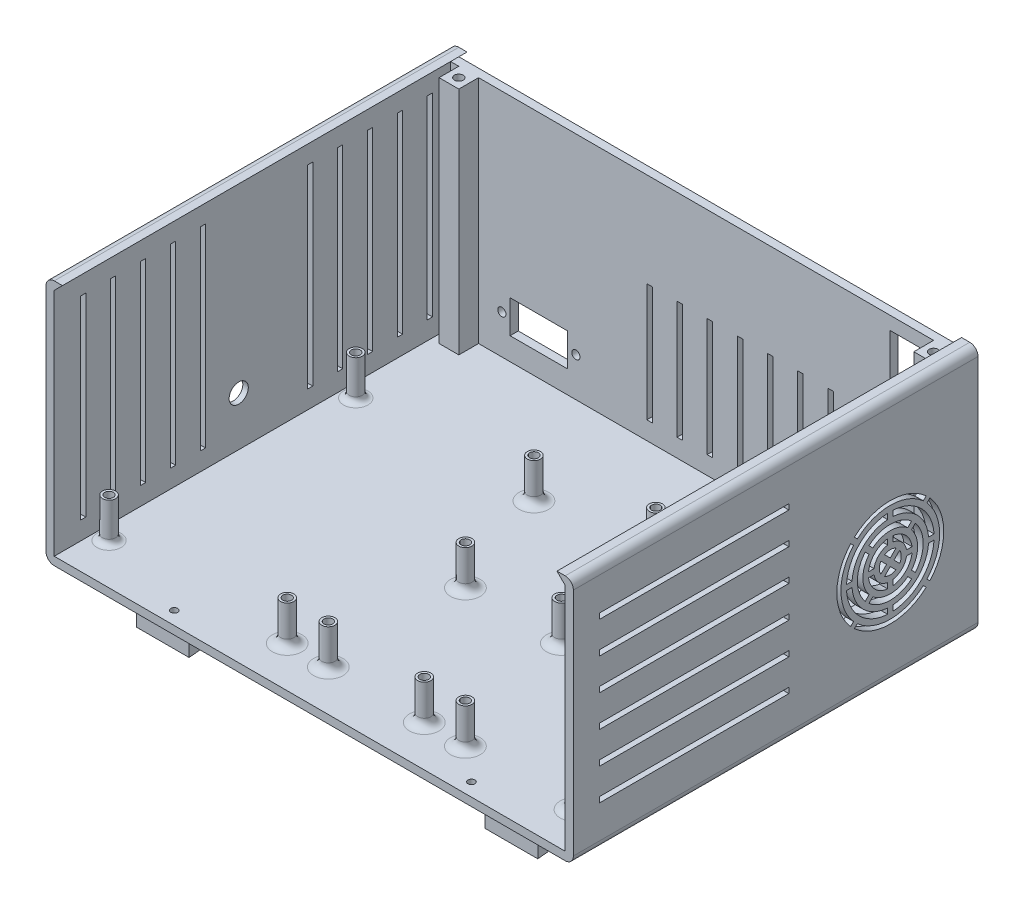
SolidWorks part; units mm, degrees
ref_plane "Front Plane" through (0, 0, 0) normal (0, 0, 1) x (1, 0, 0)
ref_plane "Top Plane" through (0, 0, 0) normal (0, 1, 0) x (1, 0, 0)
ref_plane "Right Plane" through (0, 0, 0) normal (1, 0, 0) x (0, 0, -1)
sketch "Sketch3" plane through (0, 0, 0) normal (0, 1, 0) x (1, 0, 0)
  line L1 (0, 0) -> (192.4, 0)
  line L2 (0, 0) -> (0, 147.6)
  line L3 (0, 147.6) -> (192.4, 147.6)
  line L4 (192.4, 0) -> (192.4, 147.6)
  dimension "D1" = 147.6
  dimension "D2" = 192.4
extrude "Boss-Extrude1" add sketch "Sketch3" against normal blind 3
sketch "Sketch4" plane through (0, 0, 0) normal (0, 1, 0) x (1, 0, 0)
  line L0 (192.4, 147.6) -> (0, 147.6) construction
  line L1 (0, 0) -> (3, 0)
  line L2 (0, 0) -> (0, 147.6)
  line L3 (0, 147.6) -> (3, 147.6)
  line L4 (3, 0) -> (3, 147.6)
  line L10 (192.4, 0) -> (189.4, 0)
  line L11 (192.4, 0) -> (192.4, 147.6)
  line L12 (192.4, 147.6) -> (189.4, 147.6)
  line L13 (189.4, 0) -> (189.4, 147.6)
  line L14 (3, 147.6) -> (189.4, 147.6)
  line L15 (3, 147.6) -> (3, 144.6)
  line L16 (3, 144.6) -> (189.4, 144.6)
  line L17 (189.4, 147.6) -> (189.4, 144.6)
  dimension "D1" = 3
  dimension "D2" = 3
  dimension "D3" = 3
extrude "Boss-Extrude3" add sketch "Sketch4" along normal blind 87 contours L4 L16 L13 M10
sketch "Sketch5" plane through (0, 0, 0) normal (-1, 0, 0) x (0, 0, 1)
  line L0 (0, 87) -> (-147.6, 87) construction
  line L1 (-138, 77.4) -> (-136.08, 77.4)
  line L2 (-138, 77.4) -> (-138, 6.6)
  line L3 (-138, 6.6) -> (-136.08, 6.6)
  line L4 (-136.08, 77.4) -> (-136.08, 6.6)
  line L5 (-147.6, -3) -> (0, -3) construction
  line L6 (-147.6, -3) -> (-147.6, 87) construction
  line L7 (-127.08, 77.4) -> (-127.08, 6.6)
  line L8 (-127.08, 77.4) -> (-125.16, 77.4)
  line L9 (-125.16, 77.4) -> (-125.16, 6.6)
  line L10 (-127.08, 6.6) -> (-125.16, 6.6)
  line L11 (-116.16, 77.4) -> (-116.16, 6.6)
  line L12 (-116.16, 77.4) -> (-114.24, 77.4)
  line L13 (-114.24, 77.4) -> (-114.24, 6.6)
  line L14 (-116.16, 6.6) -> (-114.24, 6.6)
  line L15 (-105.24, 77.4) -> (-105.24, 6.6)
  line L16 (-105.24, 77.4) -> (-103.32, 77.4)
  line L17 (-103.32, 77.4) -> (-103.32, 6.6)
  line L18 (-105.24, 6.6) -> (-103.32, 6.6)
  line L19 (-94.32, 77.4) -> (-94.32, 6.6)
  line L20 (-94.32, 77.4) -> (-92.4, 77.4)
  line L21 (-92.4, 77.4) -> (-92.4, 6.6)
  line L22 (-94.32, 6.6) -> (-92.4, 6.6)
  line L23 (-73.8, 87) -> (-73.8, -3) construction
  line L24 (0, -3) -> (0, 87) construction
  line L25 (-53.28, 77.4) -> (-55.2, 77.4)
  line L26 (-55.2, 77.4) -> (-55.2, 6.6)
  line L27 (-53.28, 77.4) -> (-53.28, 6.6)
  line L28 (-53.28, 6.6) -> (-55.2, 6.6)
  line L29 (-42.36, 6.6) -> (-44.28, 6.6)
  line L30 (-42.36, 77.4) -> (-44.28, 77.4)
  line L31 (-44.28, 77.4) -> (-44.28, 6.6)
  line L32 (-42.36, 77.4) -> (-42.36, 6.6)
  line L33 (-31.44, 6.6) -> (-33.36, 6.6)
  line L34 (-33.36, 77.4) -> (-33.36, 6.6)
  line L35 (-31.44, 77.4) -> (-33.36, 77.4)
  line L36 (-31.44, 77.4) -> (-31.44, 6.6)
  line L37 (-20.52, 77.4) -> (-22.44, 77.4)
  line L38 (-22.44, 77.4) -> (-22.44, 6.6)
  line L39 (-20.52, 77.4) -> (-20.52, 6.6)
  line L40 (-20.52, 6.6) -> (-22.44, 6.6)
  line L41 (-9.6, 6.6) -> (-11.52, 6.6)
  line L42 (-9.6, 77.4) -> (-11.52, 77.4)
  line L43 (-9.6, 77.4) -> (-9.6, 6.6)
  line L44 (-11.52, 77.4) -> (-11.52, 6.6)
  dimension "D1" = 1.92
  dimension "D2" = 9.6
  dimension "D3" = 9.6
  dimension "D4" = 9.6
  dimension "D6" = 9
  dimension "D7" = 73.8
  dimension "D5" = 5
extrude "Cut-Extrude2" cut sketch "Sketch5" against normal up to surface (3 mm away)
sketch "Sketch6" plane through (192.4, 0, 0) normal (1, 0, 0) x (0, 0, -1)
  line L0 (0, 87) -> (147.6, 87) construction
  line L1 (9.6, 72) -> (78.6, 72)
  line L2 (9.6, 72) -> (9.6, 70)
  line L3 (9.6, 70) -> (78.6, 70)
  line L4 (78.6, 72) -> (78.6, 70)
  line L5 (0, -3) -> (0, 87) construction
  line L6 (9.6, 58.4) -> (78.6, 58.4)
  line L7 (9.6, 60.4) -> (78.6, 60.4)
  line L8 (9.6, 60.4) -> (9.6, 58.4)
  line L9 (78.6, 60.4) -> (78.6, 58.4)
  line L10 (9.6, 46.8) -> (78.6, 46.8)
  line L11 (9.6, 48.8) -> (78.6, 48.8)
  line L12 (9.6, 48.8) -> (9.6, 46.8)
  line L13 (78.6, 48.8) -> (78.6, 46.8)
  line L14 (9.6, 35.2) -> (78.6, 35.2)
  line L15 (9.6, 37.2) -> (78.6, 37.2)
  line L16 (9.6, 37.2) -> (9.6, 35.2)
  line L17 (78.6, 37.2) -> (78.6, 35.2)
  line L18 (9.6, 23.6) -> (78.6, 23.6)
  line L19 (9.6, 25.6) -> (78.6, 25.6)
  line L20 (9.6, 25.6) -> (9.6, 23.6)
  line L21 (78.6, 25.6) -> (78.6, 23.6)
  line L22 (9.6, 12) -> (78.6, 12)
  line L23 (9.6, 14) -> (78.6, 14)
  line L24 (9.6, 14) -> (9.6, 12)
  line L25 (78.6, 14) -> (78.6, 12)
  line L30 (9.6, 2.4) -> (78.6, 2.4)
  line L31 (9.6, 0.4) -> (78.6, 0.4)
  line L32 (9.6, 2.4) -> (9.6, 0.4)
  line L33 (78.6, 2.4) -> (78.6, 0.4)
  dimension "D1" = 15
  dimension "D2" = 9.6
  dimension "D3" = 2
  dimension "D4" = 69
  dimension "D6" = 9.6
  dimension "D5" = 7
extrude "Cut-Extrude3" cut sketch "Sketch6" against normal up to surface (3 mm away)
sketch "Sketch7" plane through (192.4, 0, 0) normal (1, 0, 0) x (0, 0, -1)
  line L0 (0, -3) -> (147.6, -3) construction
  line L1 (147.6, -3) -> (147.6, 87) construction
  line L2 (96.1, 35) -> (135.1, 35) construction
  line L3 (115.6, 35) -> (101.8114, 48.7886)
  line L4 (115.6, 35) -> (129.3886, 48.7886)
  line L5 (115.6, 35) -> (129.3886, 21.2114)
  line L6 (101.8114, 21.2114) -> (115.6, 35)
  line L7 (109.2404, 42.7172) -> (102.507, 49.4507)
  line L8 (107.8828, 41.3596) -> (101.1493, 48.093)
  line L9 (109.2404, 27.2828) -> (102.507, 20.5493)
  line L10 (107.8828, 28.6404) -> (101.1493, 21.907)
  line L11 (115.6, 54.5) -> (115.6, 15.5) construction
  line L12 (121.9596, 27.2828) -> (128.693, 20.5493)
  line L13 (123.3172, 28.6404) -> (130.0507, 21.907)
  line L14 (123.3172, 41.3596) -> (130.0507, 48.093)
  line L15 (121.9596, 42.7172) -> (128.693, 49.4507)
  line L16 (116.56, 15.5236) -> (116.56, 54.4764)
  line L17 (114.64, 54.4764) -> (114.64, 15.5236)
  line L18 (96.1236, 35.96) -> (135.0764, 35.96)
  line L19 (96.1236, 34.04) -> (135.0764, 34.04)
  line L20 (107.8828, 41.3596) -> (121.9596, 27.2828)
  line L21 (109.2404, 42.7172) -> (123.3172, 28.6404)
  line L22 (107.8828, 28.6404) -> (121.9596, 42.7172)
  line L23 (123.3172, 41.3596) -> (109.2404, 27.2828)
  circle A0 centre (115.6, 35) radius 19.5
  circle A1 centre (115.6, 35) radius 18
  circle A2 centre (115.6, 35) radius 16
  circle A3 centre (115.6, 35) radius 14
  circle A4 centre (115.6, 35) radius 12
  circle A5 centre (115.6, 35) radius 10
  circle A6 centre (115.6, 35) radius 8
  circle A7 centre (115.6, 35) radius 6
  circle A8 centre (115.6, 35) radius 4
  circle A9 centre (115.6, 35) radius 2
  dimension "D3" = 39
  dimension "D4" = 36
  dimension "D5" = 32
  dimension "D6" = 28
  dimension "D8" = 24
  dimension "D9" = 20
  dimension "D18" = 16
  dimension "D19" = 12
  dimension "D20" = 8
  dimension "D21" = 4
  dimension "D1" = 38
  dimension "D2" = 32
  dimension "D7" = 45
  dimension "D10" = 90
  dimension "D11" = 45
  dimension "D12" = 0.96
  dimension "D13" = 0.96
  dimension "D14" = 0.96
  dimension "D15" = 0.96
  dimension "D16" = 0.96
  dimension "D17" = 0.96
extrude "Cut-Extrude5" cut sketch "Sketch7" against normal up to surface (3 mm away) contours A1 L19 A0 L10 | A1 L8 A0 L18 | A1 L17 A0 L7 | A1 L15 A0 L16 | A1 L16 A0 L17 | A1 L19 A0 L18 | A1 L18 A0 L14 | A1 L13 A0 L19 | A1 L16 A0 L12 | A1 L9 A0 L17 | A1 L17 A0 L16 | A1 L18 A0 L19 | A3 L19 A2 L10 | A3 L6 A2 L9 | A3 L10 A2 L6 | A3 L9 A2 L17 | A3 L16 A2 L12 | A3 L5 A2 L13 | A3 L12 A2 L5 | A3 L13 A2 L19 | A3 L18 A2 L14 | A3 L4 A2 L15 | A3 L14 A2 L4 | A3 L15 A2 L16 | A3 L17 A2 L7 | A3 L7 A2 L3 | A3 L3 A2 L8 | A3 L8 A2 L18 | A5 L18 A4 L19 | A5 L8 A4 L18 | A5 L17 A4 L7 | A5 L16 A4 L17 | A5 L15 A4 L16 | A5 L18 A4 L14 | A5 L13 A4 L19 | A5 L16 A4 L12 | A5 L9 A4 L17 | A5 L19 A4 L10 | A5 L17 A4 L16 | A5 L19 A4 L18 | A7 L19 A6 L22 | A7 L6 A6 L23 | A7 L22 A6 L6 | A7 L23 A6 L17 | A7 L16 A6 L20 | A7 L20 A6 L5 | A7 L5 A6 L21 | A7 L21 A6 L19 | A7 L18 A6 L23 | A7 L22 A6 L16 | A7 L23 A6 L4 | A7 L4 A6 L22 | A7 L20 A6 L18 | A7 L3 A6 L20 | A7 L21 A6 L3 | A9 L20 L18 A8 L19 L22 | A7 L17 A6 L21 | L19 A8 L22 | L20 A8 L18 | L20 A9 L22 | A9 L23 L17 A8 L16 L20 | A9 L21 L19 A8 L18 L23 | A9 L22 L16 A8 L17 L21 | L17 A8 L21 | L22 A8 L16 | L18 A8 L23 | L21 A8 L19 | L23 A9 L20 | L21 A9 L23 | L22 A9 L21
sketch "Sketch8" plane through (192.4, 0, 0) normal (1, 0, 0) x (0, 0, -1)
  line L0 (114.64, 32.6824) -> (113.5331, 31.5754)
  line L1 (116.56, 32.6824) -> (117.6669, 31.5754)
  line L2 (116.56, 31.1169) -> (116.56, 32.6824) construction
  line L3 (115.6, 33.6424) -> (114.64, 32.6824) construction
  line L4 (115.6, 33.6424) -> (116.56, 32.6824) construction
  line L5 (114.64, 32.6824) -> (114.64, 31.1169)
  line L6 (114.64, 32.6824) -> (114.64, 31.1169) construction
  line L7 (116.56, 32.6824) -> (116.56, 31.1169)
  circle A0 centre (115.6, 35) radius 4
  dimension "D1" = 8
extrude "Cut-Extrude6" cut sketch "Sketch8" against normal up to surface (3 mm away) contours L0 A0 L5 | L7 A0 L1
sketch "Sketch9" plane through (0, 0, 0) normal (0, 1, 0) x (1, 0, 0)
  line L0 (189.4, 0) -> (189.4, 144.6) construction
  line L1 (179.4, 133.8) -> (189.4, 133.8)
  line L2 (179.4, 133.8) -> (179.4, 93.8)
  line L3 (179.4, 93.8) -> (189.4, 93.8)
  line L4 (189.4, 133.8) -> (189.4, 93.8)
  line L5 (3, 144.6) -> (189.4, 144.6) construction
  dimension "D1" = 10.8
  dimension "D2" = 40
  dimension "D3" = 10
extrude "Boss-Extrude4" add sketch "Sketch9" along normal blind 15
sketch "Sketch13" plane through (189.4, 0, 0) normal (-1, 0, 0) x (0, 0, 1)
  line L0 (-115.6, 15.5) -> (-115.6, 54.5) construction
  line L1 (-135.1, 35) -> (-96.1, 35) construction
  line L2 (-93.8, 15) -> (-133.8, 15) construction
  line L3 (-133.8, 15) -> (-133.8, 0) construction
  arc A0 (-128.693, 20.5493) -> (-102.507, 20.5493) centre (-115.6, 35) ccw construction
  arc A1 (-102.507, 49.4507) -> (-128.693, 49.4507) centre (-115.6, 35) ccw construction
  arc A2 (-130.0507, 48.093) -> (-130.0507, 21.907) centre (-115.6, 35) ccw construction
  arc A3 (-101.1493, 21.907) -> (-101.1493, 48.093) centre (-115.6, 35) ccw construction
  circle A4 centre (-129.79, 19.01) radius 1.73
  circle A5 centre (-129.79, 50.99) radius 1.73
  circle A6 centre (-101.41, 50.99) radius 1.73
  circle A7 centre (-101.41, 19.01) radius 1.73
  dimension "D1" = 3.46
  dimension "D2" = 4.01
  dimension "D3" = 4.01
extrude "Boss-Extrude5" add sketch "Sketch13" along normal blind 12
fillet "Fillet1" radius 3 2 edges at (192.4, 87, -73.8) (0, 87, -73.8)
sketch "Sketch18" plane through (0, 0, 0) normal (0, 0, 1) x (1, 0, 0)
  line L0 (3, 87) -> (1.56, 84)
  line L1 (1.56, 84) -> (3, 84)
  line L2 (3, 87) -> (3, 0) construction
  line L3 (3, 84) -> (3, 87)
  line L4 (189.4, 87) -> (190.84, 84)
  line L5 (190.84, 84) -> (189.4, 84)
  line L6 (189.4, 87) -> (189.4, 0) construction
  line L7 (189.4, 87) -> (189.4, 84)
  dimension "D1" = 1.44
  dimension "D2" = 3
  dimension "D3" = 1.44
  dimension "D4" = 3
sketch "Sketch19" plane through (0, 0, -144.6) normal (0, 0, 1) x (1, 0, 0)
  line L0 (3, 87) -> (3, 84)
  line L1 (3, 87) -> (3, 0) construction
  line L2 (3, 84) -> (189.4, 84)
  line L3 (189.4, 87) -> (189.4, 0) construction
  line L4 (189.4, 84) -> (189.4, 87)
  line L5 (189.4, 87) -> (3, 87)
  dimension "D1" = 3
extrude "Cut-Extrude13" cut sketch "Sketch19" against normal up to surface (3 mm away) contours L2 M8 M6 M7
extrude "Cut-Extrude14" cut sketch "Sketch18" against normal through all
fillet "Fillet2" radius 3 2 edges at (192.4, -3, -73.8) (0, -3, -73.8)
sketch "Sketch20" plane through (0, 0, 0) normal (0, 0, 1) x (1, 0, 0)
  line L0 (1.56, 84) -> (3, 84)
  line L1 (3, 84) -> (6, 87)
  line L2 (6, 87) -> (3, 87)
  line L3 (3, 87) -> (1.56, 84)
  line L4 (189.4, 87) -> (190.84, 84)
  line L5 (190.84, 84) -> (189.4, 84)
  line L6 (189.4, 84) -> (186.4, 87)
  line L7 (186.4, 87) -> (189.4, 87)
  dimension "D1" = 3
  dimension "D2" = 1.44
  dimension "D3" = 3
extrude "Boss-Extrude6" add sketch "Sketch20" against normal up to surface (147.6 mm away)
sketch "Sketch21" plane through (0, 0, 0) normal (0, 1, 0) x (1, 0, 0)
  line L0 (3, 144.6) -> (189.4, 144.6) construction
  line L1 (6, 144.6) -> (13.2, 144.6)
  line L2 (6, 144.6) -> (6, 137.4)
  line L3 (6, 137.4) -> (13.2, 137.4)
  line L4 (13.2, 144.6) -> (13.2, 137.4)
  line L5 (3, 0) -> (3, 144.6) construction
  line L6 (189.4, 133.8) -> (189.4, 144.6) construction
  line L7 (186.4, 144.6) -> (179.2, 144.6)
  line L8 (186.4, 144.6) -> (186.4, 137.4)
  line L9 (186.4, 137.4) -> (179.2, 137.4)
  line L10 (179.2, 144.6) -> (179.2, 137.4)
  dimension "D1" = 3
  dimension "D2" = 7.2
  dimension "D3" = 7.2
  dimension "D4" = 3
  dimension "D5" = 7.2
  dimension "D6" = 7.2
extrude "Boss-Extrude7" add sketch "Sketch21" along normal blind 84
sketch "Sketch23" plane through (0, 0, 0) normal (0, 1, 0) x (1, 0, 0)
  line L0 (13.2, 144.6) -> (179.2, 144.6) construction
  line L1 (179.2, 144.6) -> (179.2, 137.4) construction
  circle A0 centre (167.4, 116.1) radius 2.4
  circle A1 centre (106.4, 116.1) radius 2.4
  dimension "D1" = 4.8
  dimension "D2" = 4.8
  dimension "D4" = 11.8
  dimension "D3" = 28.5
  dimension "D5" = 72.8
extrude "Transformer nails" add sketch "Sketch23" along normal blind 9
sketch "Sketch25" plane through (0, 0, 0) normal (0, 1, 0) x (1, 0, 0)
  line L1 (3, 0) -> (3, 144.6) construction
  line L2 (3, 0) -> (189.4, 0) construction
  line L3 (189.4, 0) -> (189.4, 93.8) construction
  circle A0 centre (42, 4.8) radius 1.25
  circle A1 centre (150.4, 4.8) radius 1.25
  dimension "D1" = 2.5
  dimension "D2" = 2.5
  dimension "D3" = 39
  dimension "D4" = 4.8
  dimension "D5" = 39
  dimension "D6" = 4.8
sketch "Sketch27" plane through (0, 0, 0) normal (0, 1, 0) x (1, 0, 0)
  line L0 (3, 0) -> (3, 144.6) construction
  line L1 (3, 10) -> (78, 10)
  line L2 (78, 10) -> (78, 110)
  line L3 (78, 110) -> (3, 110)
  line L4 (3, 110) -> (3, 10)
  line L5 (3, 0) -> (189.4, 0) construction
  line L6 (40.5, 110) -> (40.5, 10) construction
  line L8 (3, 60) -> (78, 60) construction
  circle A0 centre (8, 15) radius 2.4
  circle A1 centre (73, 15) radius 2.4
  circle A2 centre (73, 105) radius 2.4
  circle A3 centre (8, 105) radius 2.4
  dimension "D4" = 4.8
  dimension "D1" = 10
  dimension "D2" = 100
  dimension "D3" = 75
  dimension "D5" = 5
  dimension "D6" = 5
extrude "main PCB" add sketch "Sketch27" along normal blind 14.4 contours A0 | A3 | A2 | A1
sketch "Sketch28" plane through (0, 0, 0) normal (0, 1, 0) x (1, 0, 0)
  line L0 (83, 10) -> (128, 10) construction
  line L1 (128, 10) -> (128, 70) construction
  line L2 (128, 70) -> (83, 70) construction
  line L3 (83, 70) -> (83, 10) construction
  line L4 (189.4, 0) -> (189.4, 93.8) construction
  line L5 (3, 0) -> (189.4, 0) construction
  line L6 (3, 0) -> (3, 144.6) construction
  line L7 (105.5, 70) -> (105.5, 10) construction
  line L9 (83, 40) -> (128, 40) construction
  circle A0 centre (88, 15) radius 2.4
  circle A1 centre (88, 65) radius 2.4
  circle A2 centre (123, 15) radius 2.4
  circle A3 centre (123, 65) radius 2.4
  dimension "D5" = 4.8
  dimension "D1" = 45
  dimension "D2" = 60
  dimension "D3" = 10
  dimension "D4" = 80
  dimension "D6" = 5
  dimension "D7" = 5
extrude "Power supply" add sketch "Sketch28" along normal blind 14.4
sketch "Sketch30" plane through (0, 0, 0) normal (-1, 0, 0) x (0, 0, 1)
  line L0 (0, 0) -> (0, 84) construction
  line L1 (-147.6, 0) -> (0, 0) construction
  circle A0 centre (-67.3, 17.9) radius 3.5
  dimension "D2" = 7
  dimension "D1" = 67.3
  dimension "D3" = 17.9
extrude "Cut-Extrude15" cut sketch "Sketch25" against normal up to surface (3 mm away) contours A0 | A1
sketch "Sketch31" plane through (0, 0, 0) normal (0, 1, 0) x (1, 0, 0)
  line L0 (183, 10) -> (183, 78) construction
  line L1 (183, 78) -> (133, 78) construction
  line L2 (133, 78) -> (133, 10) construction
  line L3 (133, 10) -> (183, 10) construction
  line L4 (3, 0) -> (3, 144.6) construction
  line L5 (133, 44) -> (183, 44) construction
  line L6 (158, 78) -> (158, 10) construction
  line L7 (3, 0) -> (189.4, 0) construction
  circle A0 centre (138, 15) radius 2.4
  circle A1 centre (138, 73) radius 2.4
  circle A2 centre (178, 15) radius 2.4
  circle A3 centre (178, 73) radius 2.4
  dimension "D6" = 4.8
  dimension "D1" = 68
  dimension "D2" = 50
  dimension "D3" = 130
  dimension "D4" = 10
  dimension "D5" = 50
  dimension "D7" = 5
  dimension "D8" = 5
extrude "Boss-Extrude8" add sketch "Sketch31" along normal blind 14.4
fillet "Fillet5" radius 2.04 2 edges at (8, 0, -17.4) (8, 0, -107.4)
fillet "Fillet6" radius 3 12 edges at (178, 0, -75.4) (167.4, 0, -118.5) (178, 0, -17.4) (138, 0, -17.4) (123, 0, -17.4) (123, 0, -67.4) (138, 0, -75.4) (106.4, 0, -118.5) (88, 0, -67.4) (88, 0, -17.4) (73, 0, -107.4) (73, 0, -17.4)
fillet "Fillet7" radius 1.44 4 edges at (189.4, 50.99, -131.52) (189.4, 50.99, -99.68) (189.4, 19.01, -103.14) (189.4, 19.01, -128.06)
hole_wizard "M3 Clearance Hole2" positions "Sketch38" profile "Sketch39" hole size "M3" standard "ANSI Metric"
sketch "Sketch38" plane through (0, 14.4, 0) normal (0, 1, 0) x (1, 0, 0)
  point P0 (8, 105)
  point P3 (8, 15)
  point P6 (73, 105)
  point P9 (88, 65)
  point P12 (73, 15)
  point P15 (88, 15)
  point P18 (123, 65)
  point P21 (138, 73)
  point P24 (123, 15)
  point P27 (138, 15)
  point P30 (178, 15)
  point P33 (178, 73)
sketch "Sketch39" plane through (8, 14.4, -105) normal (1, 0, 0) x (0, 0, 1)
  line L0 (0, 0) -> (0, 10.9614)
  line L1 (0, 10.9614) -> (1.6, 10)
  line L2 (1.6, 10) -> (1.6, 0)
  line L5 (1.6, 0) -> (0, 0)
  line L10 (0, 10.9614) -> (-1.6, 10) construction
  line L11 (0, -6.35) -> (0, 107.95) construction
  dimension "Hole Dia." = 3.2
  dimension "Hole Depth" = 10
  dimension "Drill Angle" = 118
hole_wizard "M3 Clearance Hole3" positions "Sketch41" profile "Sketch40" hole size "M3" standard "ANSI Metric"
sketch "Sketch41" plane through (0, 9, 0) normal (0, 1, 0) x (1, 0, 0)
  point P0 (167.4, 116.1)
  point P3 (106.4, 116.1)
sketch "Sketch40" plane through (167.4, 9, -116.1) normal (1, 0, 0) x (0, 0, 1)
  line L0 (0, 0) -> (0, 8.9614)
  line L1 (0, 8.9614) -> (1.6, 8)
  line L2 (1.6, 8) -> (1.6, 0)
  line L5 (1.6, 0) -> (0, 0)
  line L10 (0, 8.9614) -> (-1.6, 8) construction
  line L11 (0, -6.35) -> (0, 107.95) construction
  dimension "Hole Dia." = 3.2
  dimension "Hole Depth" = 8
  dimension "Drill Angle" = 118
hole_wizard "M3 Clearance Hole4" positions "3DSketch4" profile "Sketch42" hole size "M3" standard "ANSI Metric"
sketch3d "3DSketch4"
  line L0 (6, 84, -144.6) -> (6, 84, -137.4) construction
  line L1 (3, 84, -147.6) -> (189.4, 84, -147.6) construction
  line L2 (186.4, 84, -137.4) -> (186.4, 84, -144.6) construction
  point P0 (9.6, 84, -141)
  point P7 (182.8, 84, -141)
  dimension "D1" = 3.6
  dimension "D2" = 6.6
  dimension "D3" = 3.6
  dimension "D4" = 6.6
sketch "Sketch42" plane through (9.6, 84, -141) normal (1, 0, 0) x (0, 0, 1)
  line L0 (0, 0) -> (0, 8.9614)
  line L1 (0, 8.9614) -> (1.6, 8)
  line L2 (1.6, 8) -> (1.6, 0)
  line L5 (1.6, 0) -> (0, 0)
  line L10 (0, 8.9614) -> (-1.6, 8) construction
  line L11 (0, -6.35) -> (0, 107.95) construction
  dimension "Hole Dia." = 3.2
  dimension "Hole Depth" = 8
  dimension "Drill Angle" = 118
sketch "Sketch43" plane through (0, 0, -147.6) normal (0, 0, -1) x (-1, 0, 0)
  line L0 (-192.4, 0) -> (-192.4, 84) construction
  line L1 (-175.6, 79.2) -> (-163.24, 79.2)
  line L2 (-175.6, 79.2) -> (-175.6, 59.2)
  line L3 (-175.6, 59.2) -> (-163.24, 59.2)
  line L4 (-163.24, 79.2) -> (-163.24, 59.2)
  line L5 (-3, 84) -> (-189.4, 84) construction
  point P4 (-175.6, 69.2)
  dimension "D1" = 16.8
  dimension "D2" = 4.8
  dimension "D3" = 20
  dimension "D4" = 12.36
extrude "Cut-Extrude16" cut sketch "Sketch43" against normal up to surface (3 mm away)
sketch "Sketch45" plane through (0, 0, -147.6) normal (0, 0, -1) x (-1, 0, 0)
  line L0 (0, 14.4) -> (0, 21.4) construction
  line L1 (-51.2, 21.84) -> (-19.2, 21.84)
  line L2 (-51.2, 21.84) -> (-51.2, 6.6)
  line L3 (-51.2, 6.6) -> (-19.2, 6.6)
  line L4 (-19.2, 21.84) -> (-19.2, 6.6)
  line L5 (-189.4, -3) -> (-3, -3) construction
  line L7 (-45.7, 20.22) -> (-24.7, 20.22)
  line L8 (-45.7, 20.22) -> (-45.7, 8.22)
  line L9 (-45.7, 8.22) -> (-24.7, 8.22)
  line L10 (-24.7, 20.22) -> (-24.7, 8.22)
  circle A0 centre (-21.7, 14.22) radius 1.5
  circle A1 centre (-48.7, 14.22) radius 1.5
  point P12 (-19.2, 14.22)
  dimension "D9" = 3
  dimension "D10" = 3
  dimension "D1" = 19.2
  dimension "D2" = 32
  dimension "D3" = 9.6
  dimension "D4" = 15.24
  dimension "D5" = 21
  dimension "D6" = 12
  dimension "D7" = 1.62
  dimension "D8" = 5.5
  dimension "D11" = 7.62
  dimension "D12" = 7.62
  dimension "D13" = 2.5
  dimension "D14" = 2.5
extrude "Cut-Extrude17" cut sketch "Sketch45" against normal up to surface (3 mm away) contours L10 L7 L8 L9 | A1 | A0
extrude "Cut-Extrude18" cut sketch "Sketch30" against normal up to surface (3 mm away)
sketch "Sketch46" plane through (0, 0, 0) normal (-1, 0, 0) x (0, 0, 1)
  circle A0 centre (-67.3, 17.9) radius 6
  circle A1 centre (-67.3, 17.9) radius 3.5 construction
  dimension "D1" = 12
extrude "Cut-Extrude19" cut sketch "Sketch46" against normal blind 1
sketch "Sketch47" plane through (0, -3, 0) normal (0, -1, 0) x (1, 0, 0)
  line L0 (3, 0) -> (3, -147.6) construction
  line L1 (23, -10) -> (42.2, -10)
  line L2 (23, -10) -> (23, -29.2)
  line L3 (23, -29.2) -> (42.2, -29.2)
  line L4 (42.2, -10) -> (42.2, -29.2)
  line L5 (150.2, -10) -> (169.4, -10)
  line L6 (150.2, -10) -> (150.2, -29.2)
  line L7 (150.2, -29.2) -> (169.4, -29.2)
  line L8 (169.4, -10) -> (169.4, -29.2)
  line L9 (189.4, -147.6) -> (189.4, 0) construction
  line L10 (3, 0) -> (189.4, 0) construction
  dimension "D1" = 20
  dimension "D2" = 20
  dimension "D3" = 10
  dimension "D4" = 10
  dimension "D5" = 19.2
  dimension "D6" = 19.2
  dimension "D7" = 19.2
  dimension "D8" = 19.2
extrude "Boss-Extrude9" add sketch "Sketch47" along normal blind 14.4
sketch "Sketch48" plane through (23, 0, 0) normal (-1, 0, 0) x (0, 0, 1)
  line L0 (-29.2, -17.4) -> (-10, -17.4)
  line L1 (-10, -17.4) -> (-29.2, -15.4734)
  line L2 (-29.2, -17.4) -> (-29.2, -3) construction
  line L3 (-29.2, -15.4734) -> (-29.2, -17.4)
  dimension "D1" = 5.73
extrude "Cut-Extrude20" cut sketch "Sketch48" against normal up to surface (19.2 mm away)
sketch "Sketch49" plane through (169.4, 0, 0) normal (1, 0, 0) x (0, 0, -1)
  line L0 (10, -17.4) -> (29.2, -17.4)
  line L4 (10, -17.4) -> (29.2, -15.4734)
  line L5 (29.2, -17.4) -> (29.2, -3) construction
  line L6 (29.2, -15.4734) -> (29.2, -17.4)
  dimension "D1" = 5.73
extrude "Cut-Extrude21" cut sketch "Sketch49" against normal up to surface (19.2 mm away)
sketch "Sketch51" plane through (0, 0, -147.6) normal (0, 0, -1) x (-1, 0, 0)
  line L0 (-175.6, 79.2) -> (-175.6, 59.2) construction
  line L1 (-175.6, 49.6) -> (-173.6, 49.6)
  line L2 (-175.6, 49.6) -> (-175.6, 6.6)
  line L3 (-175.6, 6.6) -> (-173.6, 6.6)
  line L4 (-173.6, 49.6) -> (-173.6, 6.6)
  line L5 (-189.4, -3) -> (-3, -3) construction
  line L6 (-175.6, 59.2) -> (-163.24, 59.2) construction
  line L7 (-164.6, 49.6) -> (-164.6, 6.6)
  line L8 (-164.6, 49.6) -> (-162.6, 49.6)
  line L9 (-162.6, 49.6) -> (-162.6, 6.6)
  line L10 (-164.6, 6.6) -> (-162.6, 6.6)
  line L11 (-153.6, 49.6) -> (-153.6, 6.6)
  line L12 (-153.6, 49.6) -> (-151.6, 49.6)
  line L13 (-151.6, 49.6) -> (-151.6, 6.6)
  line L14 (-153.6, 6.6) -> (-151.6, 6.6)
  line L15 (-142.6, 49.6) -> (-142.6, 6.6)
  line L16 (-142.6, 49.6) -> (-140.6, 49.6)
  line L17 (-140.6, 49.6) -> (-140.6, 6.6)
  line L18 (-142.6, 6.6) -> (-140.6, 6.6)
  line L19 (-131.6, 49.6) -> (-131.6, 6.6)
  line L20 (-131.6, 49.6) -> (-129.6, 49.6)
  line L21 (-129.6, 49.6) -> (-129.6, 6.6)
  line L22 (-131.6, 6.6) -> (-129.6, 6.6)
  line L23 (-120.6, 49.6) -> (-120.6, 6.6)
  line L24 (-120.6, 49.6) -> (-118.6, 49.6)
  line L25 (-118.6, 49.6) -> (-118.6, 6.6)
  line L26 (-120.6, 6.6) -> (-118.6, 6.6)
  line L27 (-109.6, 49.6) -> (-109.6, 6.6)
  line L28 (-109.6, 49.6) -> (-107.6, 49.6)
  line L29 (-107.6, 49.6) -> (-107.6, 6.6)
  line L30 (-109.6, 6.6) -> (-107.6, 6.6)
  line L31 (-98.6, 49.6) -> (-98.6, 6.6)
  line L32 (-98.6, 49.6) -> (-96.6, 49.6)
  line L33 (-96.6, 49.6) -> (-96.6, 6.6)
  line L34 (-98.6, 6.6) -> (-96.6, 6.6)
  line L35 (-87.6, 49.6) -> (-87.6, 6.6)
  line L36 (-87.6, 49.6) -> (-85.6, 49.6)
  line L37 (-85.6, 49.6) -> (-85.6, 6.6)
  line L38 (-87.6, 6.6) -> (-85.6, 6.6)
  line L39 (-76.6, 49.6) -> (-76.6, 6.6)
  line L40 (-76.6, 49.6) -> (-74.6, 49.6)
  line L41 (-74.6, 49.6) -> (-74.6, 6.6)
  line L42 (-76.6, 6.6) -> (-74.6, 6.6)
  dimension "D1" = 2
  dimension "D2" = 9.6
  dimension "D3" = 9.6
  dimension "D5" = 9
  dimension "D6" = 9.6
  dimension "D4" = 10
extrude "Cut-Extrude22" cut sketch "Sketch51" against normal up to surface (3 mm away)
